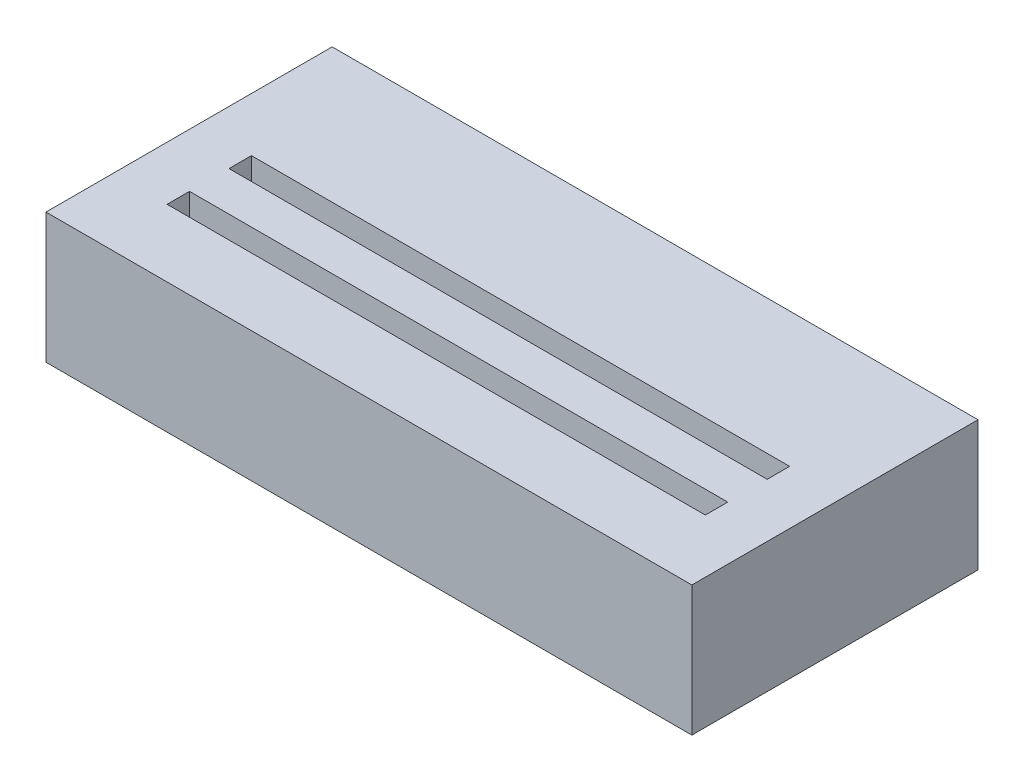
SolidWorks part; units mm, degrees
ref_plane "Front Plane" through (0, 0, 0) normal (0, 0, 1) x (1, 0, 0)
ref_plane "Top Plane" through (0, 0, 0) normal (0, 1, 0) x (1, 0, 0)
ref_plane "Right Plane" through (0, 0, 0) normal (1, 0, 0) x (0, 0, -1)
sketch "Sketch1" plane through (0, 0, 0) normal (0, 0, 1) x (1, 0, 0)
  line L1 (-4.318, 4.953) -> (32.258, 4.953)
  line L2 (-4.318, 4.953) -> (-4.318, -2.413)
  line L3 (-4.318, -2.413) -> (32.258, -2.413)
  line L4 (32.258, 4.953) -> (32.258, -2.413)
extrude "Boss-Extrude1" add sketch "Sketch1" along normal blind 7.62
sketch "Sketch2" plane through (0, 0, 0) normal (0, 0, -1) x (-1, 0, 0)
  circle A0 centre (0, 0) radius 0.508
  circle A1 centre (-2.54, 0) radius 0.508
  circle A2 centre (-5.08, 0) radius 0.508
  circle A3 centre (-7.62, 0) radius 0.508
  circle A4 centre (-10.16, 0) radius 0.508
  circle A5 centre (-12.7, 0) radius 0.508
  circle A6 centre (-15.24, 0) radius 0.508
  circle A7 centre (-17.78, 0) radius 0.508
  circle A8 centre (-20.32, 0) radius 0.508
  circle A9 centre (-22.86, 0) radius 0.508
  circle A10 centre (-25.4, 0) radius 0.508
  circle A11 centre (-27.94, 0) radius 0.508
  circle A12 centre (0, 2.54) radius 0.508
  circle A13 centre (-2.54, 2.54) radius 0.508
  circle A14 centre (-5.08, 2.54) radius 0.508
  circle A15 centre (-7.62, 2.54) radius 0.508
  circle A16 centre (-10.16, 2.54) radius 0.508
  circle A17 centre (-12.7, 2.54) radius 0.508
  circle A18 centre (-15.24, 2.54) radius 0.508
  circle A19 centre (-17.78, 2.54) radius 0.508
  circle A20 centre (-20.32, 2.54) radius 0.508
  circle A21 centre (-22.86, 2.54) radius 0.508
  circle A22 centre (-25.4, 2.54) radius 0.508
  circle A23 centre (-27.94, 2.54) radius 0.508
extrude "Cut-Extrude1" cut sketch "Sketch2" against normal up to surface (7.62 mm away)
sketch "Sketch3" plane through (0, 0, 7.62) normal (0, 0, 1) x (1, 0, 0)
  line L0 (-4.318, -2.413) -> (32.258, -2.413) construction
  line L1 (-4.318, 4.953) -> (-1.27, 4.953)
  line L2 (-4.318, 4.953) -> (-4.318, -2.413)
  line L3 (-4.318, -2.413) -> (-1.27, -2.413)
  line L4 (-1.27, 4.953) -> (-1.27, -2.413)
  line L6 (32.258, 4.953) -> (29.21, 4.953)
  line L7 (32.258, 4.953) -> (32.258, -2.413)
  line L8 (32.258, -2.413) -> (29.21, -2.413)
  line L9 (29.21, 4.953) -> (29.21, -2.413)
extrude "Boss-Extrude2" add sketch "Sketch3" along normal blind 1.27
sketch "Sketch4" plane through (0, 0, 8.89) normal (0, 0, 1) x (1, 0, 0)
  line L1 (-4.318, 4.953) -> (32.258, 4.953)
  line L2 (-4.318, 4.953) -> (-4.318, -2.413)
  line L3 (-4.318, -2.413) -> (32.258, -2.413)
  line L4 (32.258, 4.953) -> (32.258, -2.413)
extrude "Boss-Extrude3" add sketch "Sketch4" along normal blind 2.2352
sketch "Sketch5" plane through (0, 0, 11.1252) normal (0, 0, 1) x (1, 0, 0)
  line L0 (-4.318, -2.413) -> (32.258, -2.413) construction
  line L1 (-4.318, 4.953) -> (-1.27, 4.953)
  line L2 (-4.318, 4.953) -> (-4.318, -2.413)
  line L3 (-4.318, -2.413) -> (-1.27, -2.413)
  line L4 (-1.27, 4.953) -> (-1.27, -2.413)
  line L6 (32.258, 4.953) -> (29.21, 4.953)
  line L7 (32.258, 4.953) -> (32.258, -2.413)
  line L8 (32.258, -2.413) -> (29.21, -2.413)
  line L9 (29.21, 4.953) -> (29.21, -2.413)
extrude "Boss-Extrude4" add sketch "Sketch5" along normal blind 1.27
sketch "Sketch6" plane through (0, 0, 12.3952) normal (0, 0, 1) x (1, 0, 0)
  line L1 (-4.318, 4.953) -> (32.258, 4.953)
  line L2 (-4.318, 4.953) -> (-4.318, -2.413)
  line L3 (-4.318, -2.413) -> (32.258, -2.413)
  line L4 (32.258, 4.953) -> (32.258, -2.413)
extrude "Boss-Extrude5" add sketch "Sketch6" along normal blind 3.81
sketch "Sketch7" plane through (0, -2.413, 0) normal (0, -1, 0) x (1, 0, 0)
  line L1 (-4.318, 0) -> (32.258, 0) construction
  line L2 (11.557, 0) -> (16.383, 0)
  line L3 (11.557, 0) -> (11.557, 7.62)
  line L4 (11.557, 7.62) -> (16.383, 7.62)
  line L5 (16.383, 0) -> (16.383, 7.62)
  line L6 (-1.27, 7.62) -> (29.21, 7.62) construction
extrude "Boss-Extrude6" add sketch "Sketch7" along normal blind 0.635
